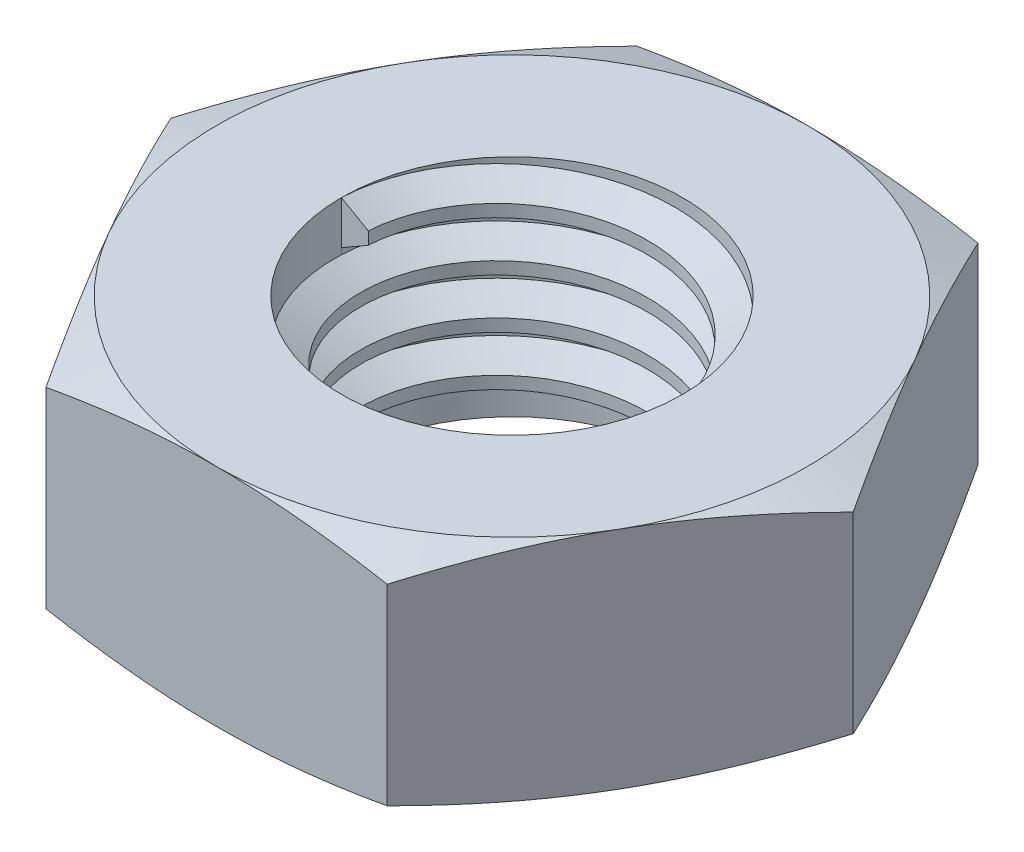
SolidWorks part; units mm, degrees
ref_plane "Front Plane" through (0, 0, 0) normal (0, 0, 1) x (1, 0, 0)
ref_plane "Top Plane" through (0, 0, 0) normal (0, 1, 0) x (1, 0, 0)
ref_plane "Right Plane" through (0, 0, 0) normal (1, 0, 0) x (0, 0, -1)
sketch "Sketch1" plane through (0, 0, 0) normal (0, 1, 0) x (1, 0, 0)
  line L1 (15.875, 0) -> (7.9375, 13.7482)
  line L2 (7.9375, 13.7482) -> (-7.9375, 13.7482)
  line L3 (-7.9375, 13.7482) -> (-15.875, 0)
  line L4 (-15.875, 0) -> (-7.9375, -13.7482)
  line L5 (-7.9375, -13.7482) -> (7.9375, -13.7482)
  line L6 (7.9375, -13.7482) -> (15.875, 0)
  circle A0 centre (0, 0) radius 13.7482 construction
  circle A1 centre (0, 0) radius 7.9375
  dimension "D1" = 15.875
extrude "Boss-Extrude1" add sketch "Sketch1" along normal blind 10.4775
sketch "Sketch2" plane through (0, 0, 0) normal (1, 0, 0) x (0, 0, -1)
  line L0 (-13.7482, 10.4775) -> (-23.3745, 10.4775)
  line L1 (-23.3745, 10.4775) -> (-23.3745, 6.9738)
  line L2 (-23.3745, 6.9738) -> (-13.7482, 10.4775)
  line L3 (-13.7482, 0) -> (-23.2404, 3.4549)
  line L4 (-23.2404, 3.4549) -> (-23.2404, 0)
  line L5 (-23.2404, 0) -> (-13.7482, 0)
  line L6 (0, 10.4775) -> (0, 12.6865) construction
  dimension "D1" = 20
  dimension "D2" = 20
revolve "Cut-Revolve1" cut sketch "Sketch2" angle 360 about L6
thread "Thread1" pitch 2.3091 start angle 0, offset 0, length 8.382, pitch 2.3091, diameter 15.875
ref_plane "Plane1" through (-7.9375, 10.4775, 0) normal (0, 0, 1) x (-1, 0, 0)
sketch "Thread Profile1" plane through (-7.9375, 10.4775, 0) normal (0, 0, 1) x (-1, 0, 0)
  line L0 (0, 0) -> (0, 2.3091) construction
  line L11 (0, 0) -> (0, 2.0205)
  line L12 (0, 2.0205) -> (-1.2498, 1.2989)
  line L13 (-1.2498, 1.2989) -> (-1.2498, 0.7216)
  line L15 (-1.2498, 0.7216) -> (0, 0)
  line L17 (-1.2498, 1.0102) -> (0, 1.0102) construction
  point P2 (0, 0)
  dimension "Pitch" = 2.3091
  dimension "Profile_Angle" = 60
  dimension "Profile_Land" = 0.5773
  dimension "Profile_Height" = 1.2498
